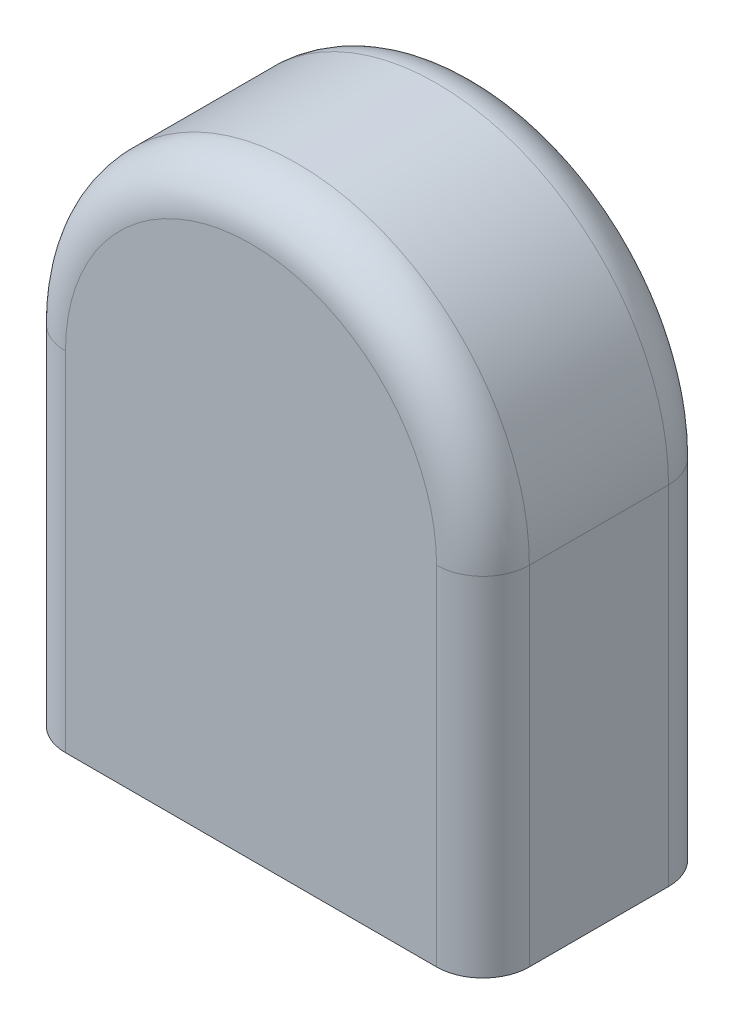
SolidWorks part; units mm, degrees
ref_plane "Front" through (0, 0, 0) normal (0, 0, 1) x (1, 0, 0)
ref_plane "Top" through (0, 0, 0) normal (0, 1, 0) x (1, 0, 0)
ref_plane "Right" through (0, 0, 0) normal (1, 0, 0) x (0, 0, -1)
sketch "Sketch1" plane through (0, 0, 0) normal (0, 0, 1) x (1, 0, 0)
  line L0 (-6.35, 0) -> (6.35, 0)
  line L1 (6.35, 0) -> (6.35, 9.525)
  line L2 (-6.35, 0) -> (-6.35, 9.525)
  arc A0 (-6.35, 9.525) -> (6.35, 9.525) centre (0, 9.525) cw
  dimension "D1" = 12.7
  dimension "D2" = 15.875
extrude "Base-Extrude" add sketch "Sketch1" along normal mid plane 6.35
sketch "Sketch2" plane through (0, 0, -3.175) normal (0, 0, -1) x (-1, 0, 0)
  circle A2 centre (0, 9.525) radius 3.175
  dimension "D1" = 6.35
extrude "Cut-Extrude1" cut sketch "Sketch2" against normal blind 3.175
fillet "Fillet1" radius 1.27 6 edges at (6.35, 4.7625, 3.175) (0, 15.875, 3.175) (-6.35, 4.7625, 3.175) (0, 15.875, -3.175) (6.35, 4.7625, -3.175) (-6.35, 4.7625, -3.175)
fillet "Fillet2" radius 0.635 2 edges at (-3.175, 9.525, 0) (-3.175, 9.525, -3.175)
